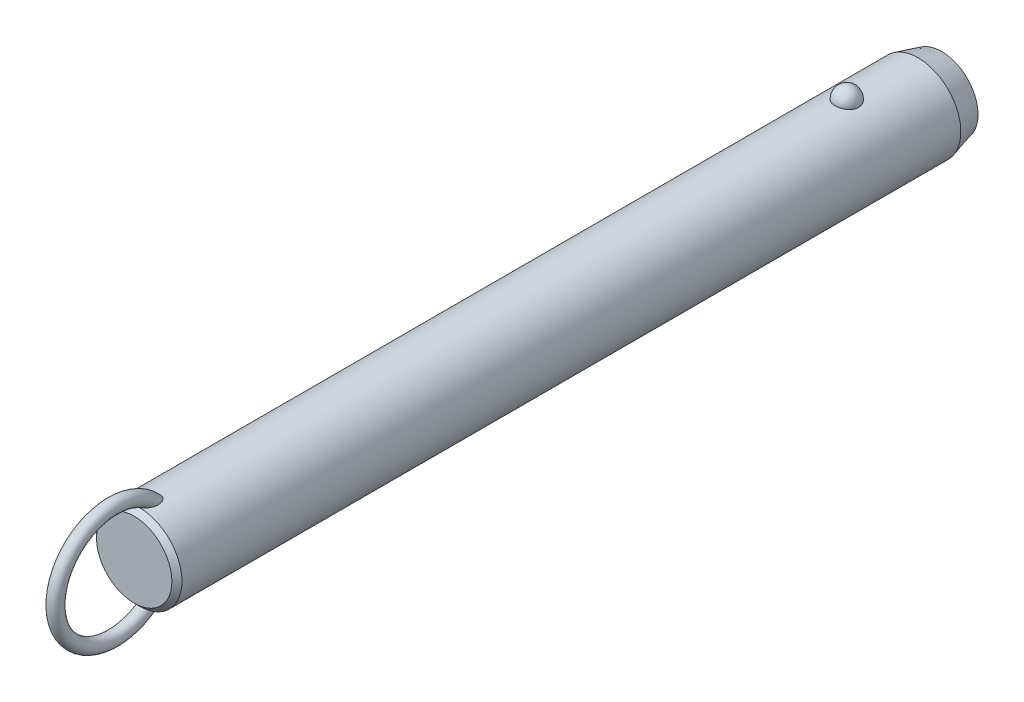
SolidWorks part; units mm, degrees
ref_plane "Front Plane" through (0, 0, 0) normal (0, 0, 1) x (1, 0, 0)
ref_plane "Top Plane" through (0, 0, 0) normal (0, 1, 0) x (1, 0, 0)
ref_plane "Right Plane" through (0, 0, 0) normal (1, 0, 0) x (0, 0, -1)
sketch "Sketch2" plane through (0, 0, 0) normal (0, 0, 1) x (1, 0, 0)
  circle A0 centre (0, 0) radius 12.7
  point P3 (0, 12.7)
  dimension "D1" = 25.4
extrude "Boss-Extrude1" add sketch "Sketch2" along normal blind 195.6
sketch "Sketch3" plane through (0, 0, 0) normal (0, 0, -1) x (-1, 0, 0)
  circle A0 centre (0, 0) radius 12.7
  dimension "D1" = 25.4
extrude "Boss-Extrude2" add sketch "Sketch3" along normal blind 31.7
chamfer "Chamfer1" distance 7 angle 15 1 edges at (-12.7, 0, -31.7)
sketch "Sketch12" plane through (0, 0, 0) normal (1, 0, 0) x (0, 0, -1)
  line L0 (-195.6, 12.7) -> (-195.6, -12.7) construction
  point P0 (-195.6, 0)
sketch "Sketch13" plane through (0, 0, 0) normal (1, 0, 0) x (0, 0, -1)
  circle A0 centre (-214.65, 0) radius 19.05
  point P2 (-195.6, 0)
  dimension "D1" = 38.1
sketch "Sketch14" plane through (0, 0, 0) normal (0, 1, 0) x (1, 0, 0)
  circle A0 centre (0, -197.6) radius 2
  point P2 (0, -195.6)
  dimension "D1" = 4
sweep "Sweep1" add profiles "Sketch14" path "Sketch13"
sketch "Sketch15" plane through (0, 0, 195.6) normal (0, 0, 1) x (1, 0, 0)
  circle A0 centre (0, 0) radius 12.7
  dimension "D1" = 25.4
extrude "Boss-Extrude3" add sketch "Sketch15" along normal blind 12.7
chamfer "Chamfer2" distance 1.5 angle 45 1 edges at (12.7, 0, 208.3)
sketch "Sketch18" plane through (0, 0, 0) normal (1, 0, 0) x (0, 0, -1)
  line L0 (24.7, 12.7) -> (-200.451, 12.7) construction
  line L1 (3.5, 16.2) -> (3.5, 9.2)
  line L2 (-200.451, -12.7) -> (24.7, -12.7) construction
  arc A0 (3.5, 16.2) -> (3.5, 9.2) centre (3.5, 12.7) ccw
  point P4 (0, 12.7)
  dimension "D1" = 28.9
revolve "Revolve1" add sketch "Sketch18" angle 360 about L1
